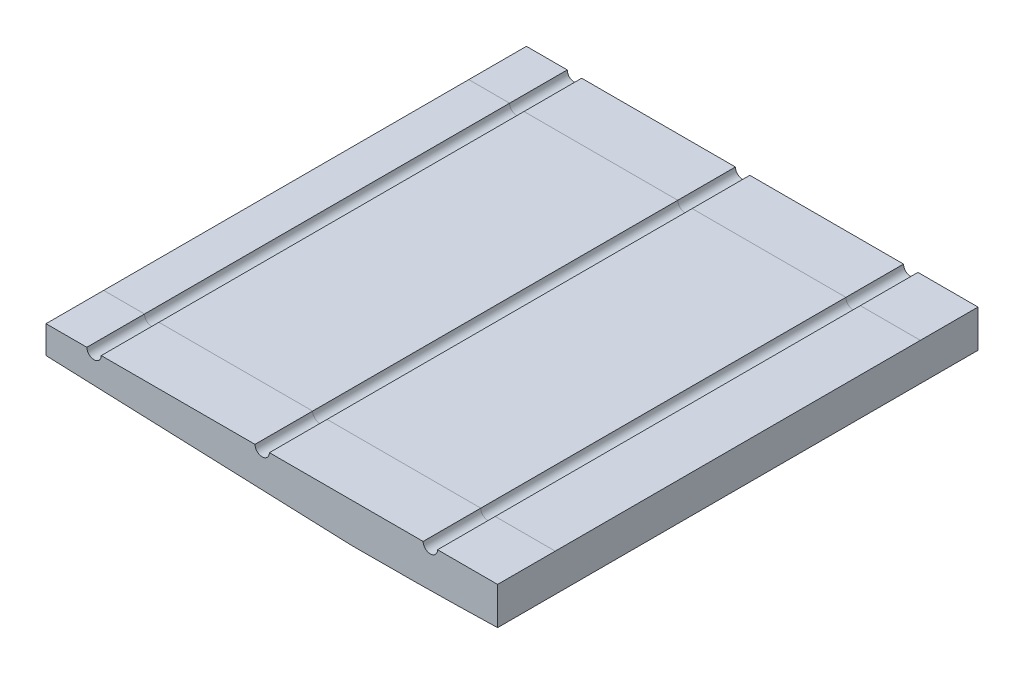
SolidWorks part; units mm, degrees
ref_plane "Front Plane" through (0, 0, 0) normal (0, 0, 1) x (1, 0, 0)
ref_plane "Top Plane" through (0, 0, 0) normal (0, 1, 0) x (1, 0, 0)
ref_plane "Right Plane" through (0, 0, 0) normal (1, 0, 0) x (0, 0, -1)
sketch "Sketch2" plane through (0, 0, 0) normal (0, 0, 1) x (1, 0, 0)
  line L0 (94, 5.75) -> (94, -2.0526)
  line L1 (0, 5.75) -> (0, 0)
  line L2 (0, 5.75) -> (94, 5.75)
  line L3 (0, 0) -> (63.6108, -2.4203)
  line L4 (63.6108, -2.4203) -> (76.9672, -2.3706)
  spline S0 degree 3 poles (76.9672, -2.3706) (82.644, -2.2657) (88.3253, -2.2644) (94, -2.0526) knots 0.590928 0.590928 0.590928 0.590928 0.626803 0.626803 0.626803 0.626803
extrude "Boss-Extrude1" add sketch "Sketch2" along normal blind 100
sketch "Sketch3" plane through (0, 0, 100) normal (0, 0, 1) x (1, 0, 0)
  line L0 (94, 5.75) -> (0, 5.75) construction
  line L1 (0, 5.75) -> (0, 0) construction
  circle A0 centre (10, 5.75) radius 1.5
  circle A1 centre (45, 5.75) radius 1.5
  circle A2 centre (80, 5.75) radius 1.5
  point P10 (0, 0)
  point P11 (0, 0)
  dimension "D1" = 3
  dimension "D4" = 35
  dimension "D2" = 10
  dimension "D3" = 35
extrude "Cut-Extrude1" cut sketch "Sketch3" against normal through all and the other way through all
sketch "Sketch4" plane through (0, 5.75, 0) normal (0, 1, 0) x (1, 0, 0)
  line L0 (0, -88) -> (94, -88)
  line L1 (0, -100) -> (0, 0) construction
  line L2 (94, -100) -> (94, 0) construction
  line L3 (0, -12) -> (94, -12)
  line L4 (94, 0) -> (81.5, 0) construction
  line L5 (94, -100) -> (81.5, -100) construction
  dimension "D1" = 12
  dimension "D2" = 12
